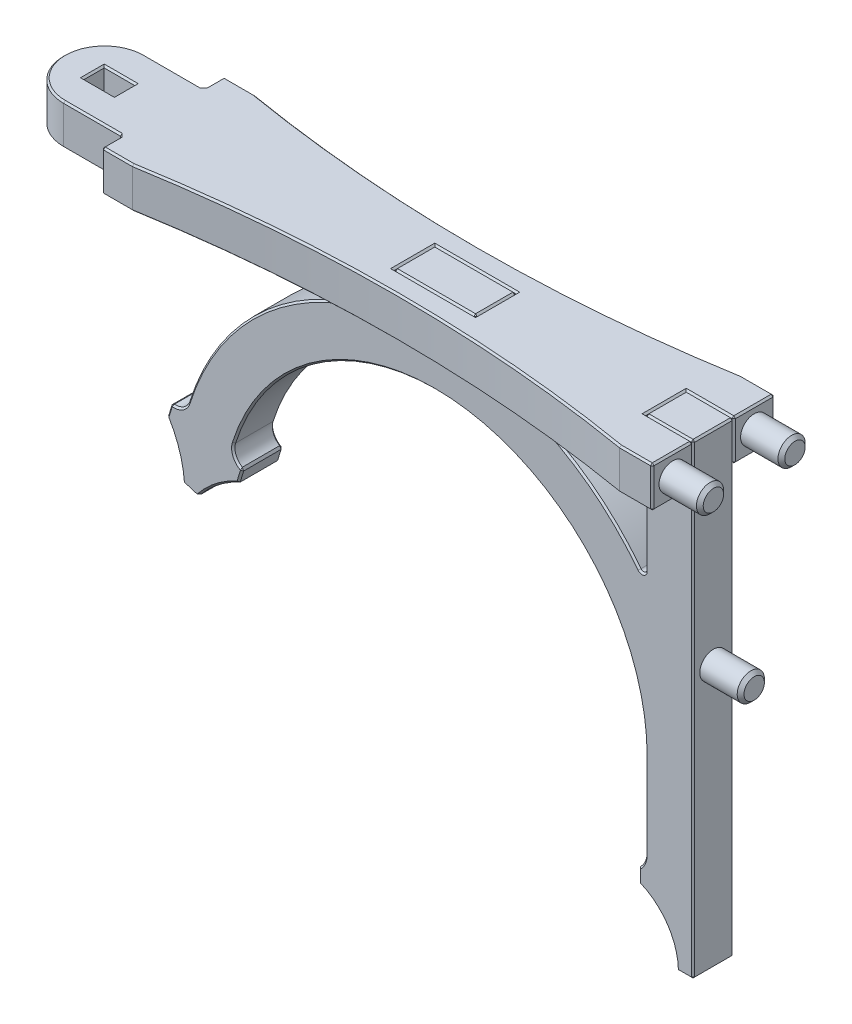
SolidWorks part; units mm, degrees
ref_plane "Спереди" through (0, 0, 0) normal (0, 0, 1) x (1, 0, 0)
ref_plane "Сверху" through (0, 0, 0) normal (0, 1, 0) x (1, 0, 0)
ref_plane "Справа" through (0, 0, 0) normal (1, 0, 0) x (0, 0, -1)
sketch "Эскиз1" plane through (0, 0, 0) normal (0, 0, 1) x (1, 0, 0)
  line L0 (0, 0) -> (0, 43.5) construction
  line L1 (-6.1441, 37.5) -> (-6, 37.5)
  line L2 (31, 37.5) -> (38, 37.5) construction
  line L3 (38, 37.5) -> (38, -25.15)
  line L4 (31, 37.5) -> (31, 23.4947)
  line L5 (35.6, -25.15) -> (38, -25.15)
  line L6 (30, -14.8169) -> (30, -16.8169)
  line L7 (31, 0) -> (31, -12.5809)
  line L8 (31, 37.5) -> (31, 43.5)
  line L9 (31, 43.5) -> (38, 43.5)
  line L10 (38, 43.5) -> (38, 37.5)
  line L11 (-6, 37.5) -> (-6, 43.5)
  line L12 (-6, 43.5) -> (6, 43.5)
  line L13 (6, 37.5) -> (6, 43.5)
  line L14 (6, 37.5) -> (6.1441, 37.5)
  line L15 (0, 0) -> (-36.3396, 11.1101) construction
  line L16 (-34.8738, 0) -> (-37.0733, 0.6725)
  line L17 (0, 0) -> (-38, 0) construction
  line L18 (-35.9736, 0.3362) -> (-32.2744, 12.4358) construction
  line L19 (-28.2951, 6.6397) -> (-28.8798, 4.7271)
  line L20 (-38.8144, 9.8558) -> (-39.3992, 7.9432)
  arc A0 (31, 0) -> (-29.5451, 9.3855) centre (0, 0) ccw
  arc A1 (-6.1441, 37.5) -> (-36.2521, 11.3925) centre (0, 0) ccw
  arc A2 (35.6, -25.15) -> (30, -16.8169) centre (26.6, -25.15) ccw
  arc A3 (30, -14.8169) -> (31, -12.5809) centre (28, -12.5809) ccw
  arc A4 (30.1039, 23.1896) -> (6.1441, 37.5) centre (0, 0) ccw
  arc A5 (31, 23.4947) -> (30.1039, 23.1896) centre (30.5, 23.4947) cw
  circle A6 centre (0, 0) radius 34.5 construction
  arc A7 (-28.8798, 4.7271) -> (-34.8738, 0) centre (-22.255, -9.8369) ccw
  arc A8 (-39.3992, 7.9432) -> (-37.0733, 0.6725) centre (-53.0355, -0.4264) cw
  arc A9 (-29.5451, 9.3855) -> (-28.2951, 6.6397) centre (-27.4007, 8.7043) ccw
  arc A10 (-38.8144, 9.8558) -> (-36.2521, 11.3925) centre (-38.3986, 12.067) ccw
  point P24 (0, 43.5)
  point P27 (31, 21.9773)
  dimension "D1" = 76
  dimension "D2" = 62
  dimension "D6" = 18
  dimension "D9" = 6
  dimension "D13" = 0.5
  dimension "D14" = 69
  dimension "D17" = 16
  dimension "D19" = 22.255
  dimension "D21" = 4.5
  dimension "D3" = 37.5
  dimension "D4" = 7
  dimension "D5" = 62.65
  dimension "D7" = 2.4
  dimension "D8" = 1
  dimension "D10" = 2
  dimension "D11" = 68.65
  dimension "D12" = 12
  dimension "D15" = 73
  dimension "D16" = 2.3
  dimension "D18" = 11
  dimension "D20" = 2
extrude "Бобышка-Вытянуть1" add sketch "Эскиз1" along normal blind 6
chamfer "Фаска1" distance 0.25 angle 45 59 edges at (-28.2951, 6.6397, 3) (-38.8144, 9.8558, 3) (30, -16.8169, 3) (-34.8738, 0, 3) (-37.0733, 0.6725, 3) (30.6612, 23.0214, 0) (19.4853, 32.624, 0) (6.0721, 37.5, 0) (6, 40.5, 0) (0, 43.5, 0) (-6, 40.5, 0) (-6.0721, 37.5, 0) (-24.895, 28.7096, 0) (-37.2414, 10.1374, 0) (-39.1068, 8.8995, 0) (-37.7963, 4.4486, 0) (-35.9736, 0.3362, 0) (-32.1629, 2.7263, 0) (-28.5875, 5.6834, 0) (-29.4485, 7.7721, 0) (4.7488, 30.6341, 0) (31, -6.2904, 0) (30.7386, -13.8056, 0) (30, -15.8169, 0) (34.0699, -20.13, 0) (36.8, -25.15, 0) (38, 9.175, 0) (34.5, 43.5, 0) (31, 33.4973, 0) (34.5, 43.5, 6) (38, 43.5, 3) (38, 9.175, 6) (38, -25.15, 3) (36.8, -25.15, 6) (35.6, -25.15, 3) (34.0699, -20.13, 6) (30, -15.8169, 6) (30.7386, -13.8056, 6) (31, -6.2904, 6) (4.7488, 30.6341, 6) (-29.4485, 7.7721, 6) (-28.5875, 5.6834, 6) (-32.1629, 2.7263, 6) (-35.9736, 0.3362, 6) (-37.7963, 4.4486, 6) (-39.1068, 8.8995, 6) (-37.2414, 10.1374, 6) (-24.895, 28.7096, 6) (-6.0721, 37.5, 6) (-6, 40.5, 6) (-6, 43.5, 3) (0, 43.5, 6) (6, 43.5, 3) (6, 40.5, 6) (6.0721, 37.5, 6) (19.4853, 32.624, 6) (30.6612, 23.0214, 6) (31, 33.4973, 6) (31, 43.5, 3)
sketch "Эскиз3" plane through (0, 43.5, 0) normal (0, 1, 0) x (1, 0, 0)
  line L0 (-6, -5.75) -> (-6, -0.25) construction
  line L1 (-6, 0) -> (6, 0)
  line L2 (-6, 0) -> (-6, -6)
  line L3 (-6, -6) -> (6, -6)
  line L4 (6, 0) -> (6, -6)
  line L5 (6, -0.25) -> (6, -5.75) construction
  line L6 (-5.75, 0) -> (5.75, 0) construction
  line L7 (5.75, -6) -> (-5.75, -6) construction
  line L8 (38, 0) -> (31, 0)
  line L9 (31.25, 0) -> (29.9058, 0) construction
  line L10 (31, 0) -> (31, -6)
  line L11 (29.9058, -6) -> (31.25, -6) construction
  line L12 (31, -6) -> (38, -6)
  line L13 (31, -5.75) -> (31, -0.25) construction
  line L15 (38, -0.25) -> (38, -5.75) construction
  line L16 (38, 0) -> (38, 6)
  line L17 (38, 6) -> (33.2, 6)
  line L18 (43.0592, -3) -> (-51.615, -3) construction
  line L19 (-43, 6) -> (-38.5, 6)
  line L20 (-43, 6) -> (-43, 3)
  line L21 (-43, 3) -> (-51.615, 3)
  line L22 (38, -6) -> (38, -12)
  line L23 (38, -12) -> (33.2, -12)
  line L24 (-43, -12) -> (-38.5, -12)
  line L25 (-43, -12) -> (-43, -9)
  line L26 (-43, -9) -> (-51.615, -9)
  line L27 (-48.64, -1.5) -> (-53.14, -1.5)
  line L28 (-48.64, -1.5) -> (-48.64, -4.5)
  line L29 (-48.64, -4.5) -> (-53.14, -4.5)
  line L30 (-53.14, -1.5) -> (-53.14, -4.5)
  line L31 (-48.64, -1.5) -> (-53.14, -4.5) construction
  line L32 (-48.64, -4.5) -> (-53.14, -1.5) construction
  arc A0 (-51.615, 3) -> (-51.615, -9) centre (-51.615, -3) ccw
  arc A1 (-38.5, 6) -> (33.2, 6) centre (-2.65, 218.7038) ccw
  arc A2 (-38.5, -12) -> (33.2, -12) centre (-2.65, -224.7038) cw
  point P42 (-50.89, -3)
  dimension "D3" = 12
  dimension "D1" = 4.5
  dimension "D2" = 18
  dimension "D4" = 4.8
  dimension "D5" = 4.5
  dimension "D6" = 81
  dimension "D7" = 3
  dimension "D8" = 86.64
  dimension "D9" = 0.725
extrude "Бобышка-Вытянуть2" add sketch "Эскиз3" against normal blind 6 separate body
chamfer "Фаска2" distance 0.25 angle 45 56 edges at (6, 37.5, 3) (0, 37.5, 6) (-6, 37.5, 3) (0, 37.5, 0) (-48.64, 37.5, 3) (-50.89, 37.5, 4.5) (-53.14, 37.5, 3) (-50.89, 37.5, 1.5) (0, 43.5, 6) (6, 43.5, 3) (0, 43.5, 0) (-6, 43.5, 3) (-50.89, 43.5, 4.5) (-48.64, 43.5, 3) (-50.89, 43.5, 1.5) (-53.14, 43.5, 3) (35.6, 37.5, -6) (-2.65, 37.5, -3) (-40.75, 37.5, -6) (-43, 37.5, -4.5) (-47.3075, 37.5, -3) (-57.615, 37.5, 3) (-47.3075, 37.5, 9) (-43, 37.5, 10.5) (-40.75, 37.5, 12) (-2.65, 37.5, 9) (35.6, 37.5, 12) (38, 37.5, 9) (34.5, 37.5, 6) (31, 37.5, 3) (34.5, 37.5, 0) (38, 37.5, -3) (34.5, 43.5, 0) (31, 43.5, 3) (34.5, 43.5, 6) (38, 40.5, 6) (38, 43.5, 9) (38, 40.5, 12) (35.6, 43.5, 12) (-2.65, 43.5, 9) (-40.75, 43.5, 12) (-43, 40.5, 12) (-43, 43.5, 10.5) (38, 40.5, 0) (38, 43.5, -3) (38, 40.5, -6) (35.6, 43.5, -6) (-2.65, 43.5, -3) (-40.75, 43.5, -6) (-43, 40.5, -6) (-43, 43.5, -4.5) (-43, 40.5, -3) (-47.3075, 43.5, -3) (-57.615, 43.5, 3) (-47.3075, 43.5, 9) (-43, 40.5, 9)
sketch "Эскиз5" plane through (38, 0, 0) normal (1, 0, 0) x (0, 0, -1)
  line L0 (-3, 43.5) -> (-3, 30.3277) construction
  line L1 (-5.75, 43.5) -> (-0.25, 43.5) construction
  line L2 (-9, 40.5) -> (-3, 40.5) construction
  line L3 (-3, 40.5) -> (3, 40.5) construction
  circle A0 centre (-9, 40.5) radius 2
  circle A1 centre (3, 40.5) radius 2
  dimension "D2" = 4
  dimension "D1" = 3
  dimension "D3" = 12
extrude "Бобышка-Вытянуть3" add sketch "Эскиз5" along normal blind 6
sketch "Эскиз6" plane through (38, 0, 0) normal (1, 0, 0) x (0, 0, -1)
  line L0 (0, 43.25) -> (0, -24.9) construction
  line L1 (-11, 40.5) -> (5, 40.5) construction
  circle A0 centre (-3, 13.5) radius 2
  circle A1 centre (-9, 40.5) radius 2 construction
  circle A2 centre (-9, 40.5) radius 2 construction
  circle A3 centre (3, 40.5) radius 2 construction
  dimension "D1" = 4
  dimension "D2" = 3
  dimension "D3" = 27
extrude "Бобышка-Вытянуть4" add sketch "Эскиз6" along normal blind 6
chamfer "Фаска3" distance 0.5 angle 45 2 edges at (44, 40.5, -5) (44, 40.5, 7)
chamfer "Фаска4" distance 0.5 angle 45 1 edges at (44, 15.5, 3)
